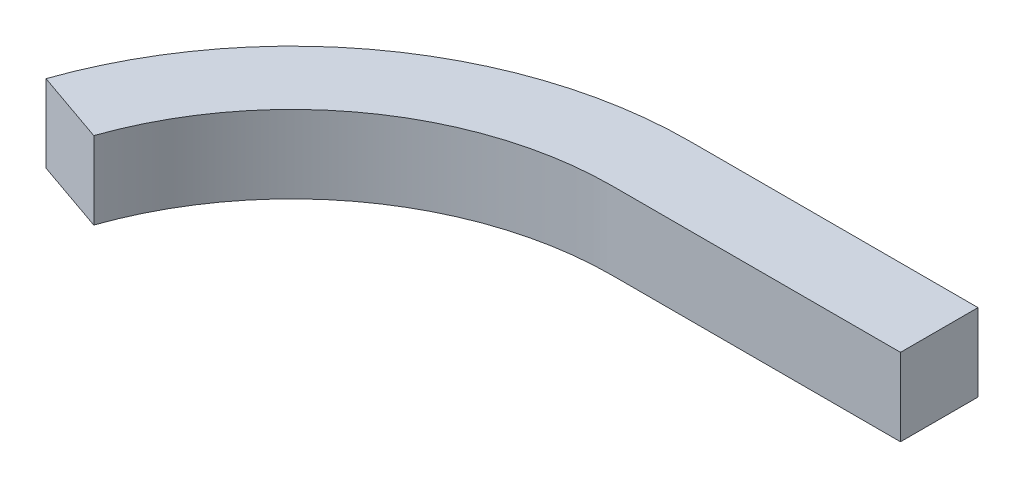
SolidWorks part; units mm, degrees
ref_plane "Front Plane" through (0, 0, 0) normal (0, 0, 1) x (1, 0, 0)
ref_plane "Top Plane" through (0, 0, 0) normal (0, 1, 0) x (1, 0, 0)
ref_plane "Right Plane" through (0, 0, 0) normal (1, 0, 0) x (0, 0, -1)
sketch "Sketch1" plane through (0, 0, 0) normal (0, 1, 0) x (1, 0, 0)
  line L0 (0, 0) -> (-156, 0)
  arc A0 (-156, 0) -> (-340.1983, -131) centre (-156, -195) ccw
  point P5 (-399.0275, -182.3003)
  point P7 (0, 0)
  dimension "D1" = 195
  dimension "D2" = 156
  dimension "D3" = 131
sketch "Sketch2" plane through (0, 0, 0) normal (1, 0, 0) x (0, 0, -1)
  line L0 (21, -21) -> (-21, 21) construction
  line L1 (21, -21) -> (-21, -21)
  line L2 (21, -21) -> (21, 21)
  line L3 (21, 21) -> (-21, 21)
  line L4 (-21, -21) -> (-21, 21)
  line L5 (-21, -21) -> (21, 21) construction
  point P4 (91.1533, -51.9087)
  point P5 (0, 0)
  dimension "D1" = 42
sweep "Sweep1" add profiles "Sketch2" path "Sketch1"
